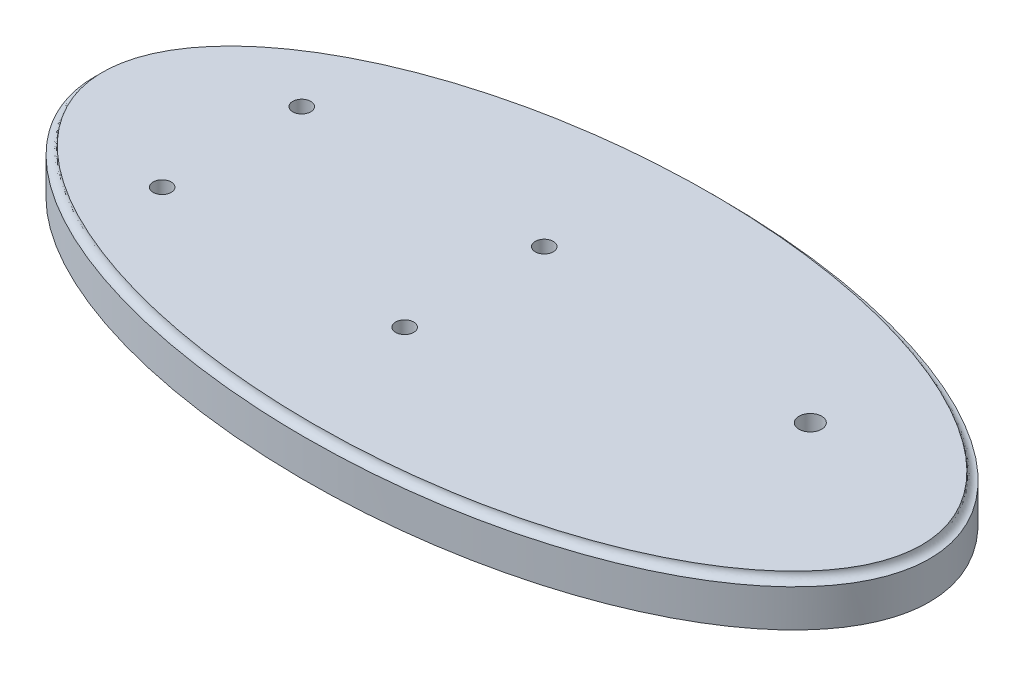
SolidWorks part; units mm, degrees
ref_plane "Front Plane" through (0, 0, 0) normal (0, 0, 1) x (1, 0, 0)
ref_plane "Top Plane" through (0, 0, 0) normal (0, 1, 0) x (1, 0, 0)
ref_plane "Right Plane" through (0, 0, 0) normal (1, 0, 0) x (0, 0, -1)
sketch "Sketch1" plane through (0, 0, 0) normal (0, 1, 0) x (1, 0, 0)
  ellipse E0 centre (0, 0) end of major axis (92.1, 0) minor radius 45.7
  dimension "D1" = 91.4
  dimension "D2" = 184.2
extrude "Boss-Extrude1" add sketch "Sketch1" against normal blind 10
sketch "Sketch2" plane through (0, 0, 0) normal (0, 1, 0) x (1, 0, 0)
  ellipse E0 centre (0, 0) end of major axis (92.1, 0) minor radius 45.7
  ellipse E1 centre (0, 0) end of major axis (92.1, 0) minor radius 45.7 construction
  dimension "D1" = 91.4
sketch "Sketch3" plane through (0, 0, 0) normal (1, 0, 0) x (0, 0, -1)
  circle A0 centre (-45.7, 0) radius 1.75
  dimension "D1" = 3.5
sweep "Cut-Sweep1" cut profiles "Sketch3" path "Sketch2"
sketch "Sketch4" plane through (0, -10, 0) normal (0, -1, 0) x (1, 0, 0)
  line L0 (92.1, -45.7) -> (92.1, 45.7) construction
  line L1 (92.1, 45.7) -> (-92.1, 45.7) construction
  line L2 (-56.3767, -45.7) -> (58.8172, -45.7) construction
hole_wizard "Ø4.0mm Dowel Hole1" positions "Sketch6" profile "Sketch5" hole size "Ø4.0" standard "ANSI Metric"
sketch "Sketch6" plane through (0, -10, 0) normal (0, -1, 0) x (-1, 0, 0)
  line L0 (-92.1, 45.7) -> (-92.1, -45.7) construction
  line L1 (-92.1, -45.7) -> (92.1, -45.7) construction
  point P0 (61.8, -15.4)
  point P2 (61.8, 15.4)
  point P4 (8.3, 15.4)
  point P6 (8.3, -15.4)
  dimension "D1" = 153.9
  dimension "D2" = 30.3
  dimension "D3" = 100.4
  dimension "D4" = 61.1
sketch "Sketch5" plane through (-61.8, -10, 15.4) normal (1, 0, 0) x (0, 0, -1)
  line L0 (0, 0) -> (0, 11.2707)
  line L1 (0, 11.2707) -> (2, 11.2707)
  line L2 (2, 11.2707) -> (2, 0.5)
  line L3 (2, 0.5) -> (2.5, 0)
  line L5 (2.5, 0) -> (0, 0)
  line L6 (-2, 0.5) -> (-2.5, 0) construction
  line L11 (0, -6.35) -> (0, 107.95) construction
  dimension "Thru Hole Dia." = 4
  dimension "Thru Hole Depth" = 11.2707
  dimension "Near C'Sink Dia." = 5
  dimension "Near C'Sink Angle" = 90
hole_wizard "Ø5.0mm Dowel Hole1" positions "Sketch8" profile "Sketch7" hole size "Ø5.0" standard "ANSI Metric"
sketch "Sketch8" plane through (0, -10, 0) normal (0, -1, 0) x (-1, 0, 0)
  line L2 (-92.1, 45.7) -> (-92.1, -45.7) construction
  line L3 (56.3767, 45.7) -> (-58.8172, 45.7) construction
  point P0 (-54.7, 11.1)
  dimension "D1" = 37.4
  dimension "D2" = 34.6
sketch "Sketch7" plane through (54.7, -10, -11.1) normal (1, 0, 0) x (0, 0, -1)
  line L0 (0, 0) -> (0, 11.2707)
  line L1 (0, 11.2707) -> (2.5, 11.2707)
  line L2 (2.5, 11.2707) -> (2.5, 0.5)
  line L3 (2.5, 0.5) -> (3, 0)
  line L5 (3, 0) -> (0, 0)
  line L6 (-2.5, 0.5) -> (-3, 0) construction
  line L11 (0, -6.35) -> (0, 107.95) construction
  dimension "Thru Hole Dia." = 5
  dimension "Thru Hole Depth" = 11.2707
  dimension "Near C'Sink Dia." = 6
  dimension "Near C'Sink Angle" = 90
